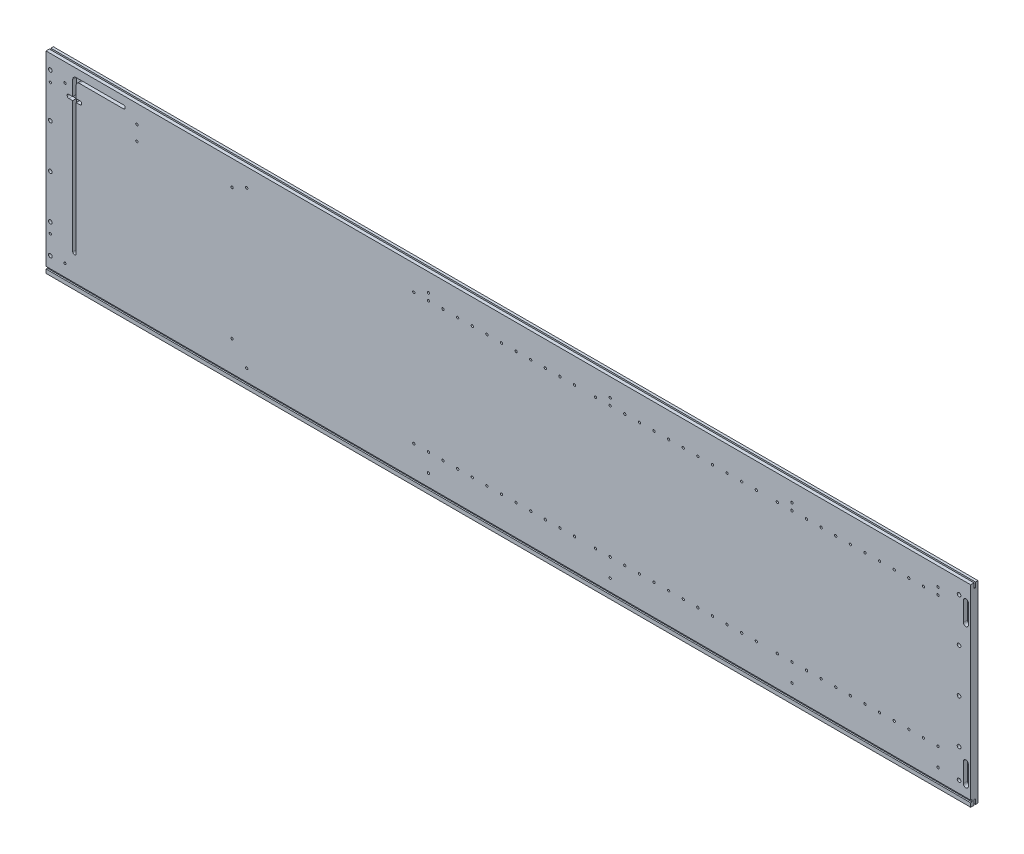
SolidWorks part; units mm, degrees
ref_plane "Ebene vorne" through (0, 0, 0) normal (0, 0, 1) x (1, 0, 0)
ref_plane "Ebene oben" through (0, 0, 0) normal (0, 1, 0) x (1, 0, 0)
ref_plane "Ebene rechts" through (0, 0, 0) normal (1, 0, 0) x (0, 0, -1)
sketch "Skizze1" plane through (0, 0, 0) normal (0, 0, 1) x (1, 0, 0)
  line L1 (-1012.5, -211) -> (1012.5, -211)
  line L2 (-1012.5, -211) -> (-1012.5, 211)
  line L3 (-1012.5, 211) -> (1012.5, 211)
  line L4 (1012.5, -211) -> (1012.5, 211)
  line L5 (-1012.5, -211) -> (1012.5, 211) construction
  line L6 (-1012.5, 211) -> (1012.5, -211) construction
  point P0 (0, 0)
  dimension "D1" = 2025
  dimension "D2" = 422
extrude "Aufsatz-Linear austragen1" add sketch "Skizze1" along normal blind 16
hole_wizard "Ø8.0 (8) Durchmesser Bohrung1 Dübel" positions "Skizze3" profile "Skizze2" hole size "Ø8.0" standard "Din"
sketch "Skizze3" plane through (0, 0, 16) normal (0, 0, 1) x (1, 0, 0)
  line L1 (-1012.5, 211) -> (-1012.5, -211) construction
  line L2 (1012.5, -211) -> (1012.5, 211) construction
  line L3 (-1012.5, -211) -> (1012.5, -211) construction
  point P0 (987, 179.5)
  point P2 (987, 83.5)
  point P4 (987, -12.5)
  point P6 (987, -108.5)
  point P8 (987, -172.5)
  point P10 (-1003, 179.5)
  point P12 (-1003, 83.5)
  point P14 (-1003, -12.5)
  point P16 (-1003, -108.5)
  point P18 (-1003, -172.5)
  dimension "D1" = 38.5
  dimension "D2" = 96
  dimension "D3" = 96
  dimension "D4" = 96
  dimension "D5" = 64
  dimension "D6" = 9.5
  dimension "D7" = 25.5
sketch "Skizze2" plane through (987, 179.5, 16) normal (1, 0, 0) x (0, -1, 0)
  line L0 (0, 0) -> (0, 13.4034)
  line L1 (0, 13.4034) -> (4, 11)
  line L2 (4, 11) -> (4, 0)
  line L5 (4, 0) -> (0, 0)
  line L10 (0, 13.4034) -> (-4, 11) construction
  line L11 (0, -6.35) -> (0, 107.95) construction
  dimension "Bohrerdurchmesser" = 8
  dimension "Bohrungstiefe" = 11
  dimension "Spitzenwinkel" = 118
sketch "Skizze4" plane through (-1012.5, 0, 0) normal (-1, 0, 0) x (0, 0, 1)
  line L0 (16, -211) -> (0, -211) construction
  line L1 (16, 211) -> (16, -211) construction
  line L6 (16, -197.5) -> (13, -197.5)
  line L7 (13, -197.5) -> (13, -202.5)
  line L8 (13, -202.5) -> (16, -202.5)
  line L9 (16, -202.5) -> (16, -197.5)
  dimension "D1" = 13.5
  dimension "D4" = 3
  dimension "D5" = 5
extrude "Schnitt-Linear austragen1 RW-Nut" cut sketch "Skizze4" against normal through all
sketch "Skizze7" plane through (1012.5, 0, 0) normal (1, 0, 0) x (0, 0, -1)
  line L0 (-8.7, 211) -> (-8.7, 200)
  line L1 (-16, 211) -> (0, 211) construction
  line L2 (-8.7, 200) -> (-5.5, 200)
  line L3 (-5.5, 200) -> (-5.5, 211)
  line L4 (-5.5, 211) -> (-8.7, 211)
  line L5 (-16, -197.5) -> (-16, 211) construction
  dimension "D1" = 7.3
  dimension "D2" = 3.2
  dimension "D3" = 11
extrude "Schnitt-Linear austragen3 Alu-Profil-Nut" cut sketch "Skizze7" against normal through all
ref_plane "Ebene1" through (0, 0, 0) normal (0, 1, 0) x (1, 0, 0)
mirror "Spiegeln1" about plane through (0, 0, 0) normal (0, 1, 0) of "Schnitt-Linear austragen3 Alu-Profil-Nut"
sketch "Skizze9" plane through (0, 0, 16) normal (0, 0, 1) x (1, 0, 0)
  line L0 (1001.9, 174) -> (1001.9, 131.8) construction
  line L1 (1007.3, 174) -> (1007.3, 131.8)
  line L2 (996.5, 174) -> (996.5, 131.8)
  line L3 (1001.9, -131.8) -> (1001.9, -174) construction
  line L4 (1007.3, -131.8) -> (1007.3, -174)
  line L5 (996.5, -131.8) -> (996.5, -174)
  line L6 (1012.5, 211) -> (-1012.5, 211) construction
  line L7 (-1012.5, -211) -> (1012.5, -211) construction
  line L8 (1012.5, -211) -> (1012.5, -202.5) construction
  arc A0 (1007.3, 174) -> (996.5, 174) centre (1001.9, 174) ccw
  arc A1 (996.5, 131.8) -> (1007.3, 131.8) centre (1001.9, 131.8) ccw
  arc A2 (1007.3, -131.8) -> (996.5, -131.8) centre (1001.9, -131.8) ccw
  arc A3 (996.5, -174) -> (1007.3, -174) centre (1001.9, -174) ccw
  point P2 (1001.9, 152.9)
  point P7 (1001.9, -152.9)
  dimension "D1" = 10.8
  dimension "D2" = 53
  dimension "D3" = 10.8
  dimension "D4" = 53
  dimension "D5" = 37
  dimension "D6" = 37
  dimension "D7" = 16
extrude "Schnitt-Linear austragen4 Höhenversteller" cut sketch "Skizze9" against normal blind 9
hole_wizard "Ø5.0 (5) Durchmesser Bohrung1 Mittelboden" positions "Skizze11" profile "Skizze10" hole size "Ø5.0" standard "Din"
sketch "Skizze11" plane through (0, 0, 16) normal (0, 0, 1) x (1, 0, 0)
  line L0 (1012.5, -211) -> (1012.5, -202.5) construction
  line L1 (-1012.5, -211) -> (1012.5, -211) construction
  line L2 (1012.5, 211) -> (-1012.5, 211) construction
  point P2 (589, 156)
  point P4 (191, 156)
  point P6 (-207, 156)
  point P8 (-207, -131)
  point P10 (191, -131)
  point P12 (589, -131)
  point P25 (-605, 156)
  point P27 (-605, -131)
  point P35 (-1003, 156)
  point P37 (-1003, -131)
  dimension "D1" = 423.5
  dimension "D2" = 398
  dimension "D3" = 398
  dimension "D4" = 398
  dimension "D5" = 80
  dimension "D6" = 55
  dimension "D7" = 398
sketch "Skizze10" plane through (589, 156, 16) normal (1, 0, 0) x (0, -1, 0)
  line L0 (0, 0) -> (0, 13.5022)
  line L1 (0, 13.5022) -> (2.5, 12)
  line L2 (2.5, 12) -> (2.5, 0)
  line L5 (2.5, 0) -> (0, 0)
  line L10 (0, 13.5022) -> (-2.5, 12) construction
  line L11 (0, -6.35) -> (0, 107.95) construction
  dimension "Bohrerdurchmesser" = 5
  dimension "Bohrungstiefe" = 12
  dimension "Spitzenwinkel" = 118
hole_wizard "Ø5.0 (5) Durchmesser Bohrung2 Verbinder" positions "Skizze13" profile "Skizze12" hole size "Ø5.0" standard "Din"
sketch "Skizze13" plane through (0, 0, 16) normal (0, 0, 1) x (1, 0, 0)
  line L0 (1012.5, -211) -> (1012.5, -202.5) construction
  line L1 (1012.5, 211) -> (-1012.5, 211) construction
  line L2 (-1012.5, -211) -> (1012.5, -211) construction
  line L4 (-1012.5, -202.5) -> (-1012.5, -211) construction
  point P0 (941, 171)
  point P2 (621, 171)
  point P4 (223, 171)
  point P6 (-175, 171)
  point P8 (-573, 171)
  point P10 (-971, 171)
  point P12 (-971, -171)
  point P14 (-573, -171)
  point P16 (-175, -171)
  point P18 (223, -171)
  point P20 (621, -171)
  point P22 (941, -171)
  dimension "D1" = 71.5
  dimension "D2" = 40
  dimension "D3" = 40
  dimension "D4" = 320
  dimension "D5" = 398
  dimension "D6" = 398
  dimension "D7" = 398
  dimension "D8" = 398
  dimension "D9" = 41.5
sketch "Skizze12" plane through (941, 171, 16) normal (1, 0, 0) x (0, -1, 0)
  line L0 (0, 0) -> (0, 16)
  line L1 (0, 16) -> (2.5, 16)
  line L2 (2.5, 16) -> (2.5, 0)
  line L5 (2.5, 0) -> (0, 0)
  line L11 (0, -6.35) -> (0, 107.95) construction
  dimension "Bohrerdurchmesser" = 5
  dimension "Bohrungstiefe" = 16
sketch "Skizze15" plane through (0, -200, 0) normal (0, -1, 0) x (1, 0, 0)
  line L0 (-1012.5, 8.7) -> (-1004.1348, 8.7)
  line L1 (-1012.5, 8.7) -> (1012.5, 8.7) construction
  line L2 (-1004.1348, 8.7) -> (-1004.1348, 5.5)
  line L3 (-1012.5, 5.5) -> (1012.5, 5.5) construction
  line L4 (-1004.1348, 5.5) -> (-1012.5, 5.5)
  line L5 (-1012.5, 5.5) -> (-1012.5, 8.7)
  dimension "D1" = 8.3652
extrude "Schnitt-Linear austragen1Alu-Profil-Nut" cut sketch "Skizze15" against normal through all
hole_wizard "Ø5.0 (5) Durchmesser Bohrung1" positions "Skizze17" profile "Skizze16" hole size "Ø5.0" standard "Din"
sketch "Skizze17" plane through (0, 0, 16) normal (0, 0, 1) x (1, 0, 0)
  circle A0 centre (191, 156) radius 2.5 construction
  point P138 (621, 156)
  point P150 (653, 156)
  point P151 (685, 156)
  point P152 (717, 156)
  point P153 (749, 156)
  point P154 (781, 156)
  point P155 (813, 156)
  point P156 (845, 156)
  point P157 (877, 156)
  point P158 (909, 156)
  point P159 (941, 156)
  point P161 (621, -131)
  point P166 (653, -131)
  point P167 (685, -131)
  point P168 (717, -131)
  point P169 (749, -131)
  point P170 (781, -131)
  point P171 (813, -131)
  point P172 (845, -131)
  point P173 (877, -131)
  point P174 (909, -131)
  point P175 (941, -131)
  point P204 (-175, 156)
  point P208 (-143, 156)
  point P209 (-111, 156)
  point P210 (-79, 156)
  point P211 (-47, 156)
  point P212 (-15, 156)
  point P213 (17, 156)
  point P214 (49, 156)
  point P215 (81, 156)
  point P216 (113, 156)
  point P217 (145, 156)
  point P219 (-175, -131)
  point P223 (-143, -131)
  point P224 (-111, -131)
  point P225 (-79, -131)
  point P226 (-47, -131)
  point P227 (-15, -131)
  point P228 (17, -131)
  point P229 (49, -131)
  point P230 (81, -131)
  point P231 (113, -131)
  point P232 (145, -131)
  point P234 (223, 156)
  point P239 (255, 156)
  point P240 (287, 156)
  point P241 (319, 156)
  point P242 (351, 156)
  point P243 (383, 156)
  point P244 (415, 156)
  point P245 (447, 156)
  point P246 (479, 156)
  point P247 (511, 156)
  point P248 (543, 156)
  point P250 (223, -131)
  point P255 (255, -131)
  point P256 (287, -131)
  point P257 (319, -131)
  point P258 (351, -131)
  point P259 (383, -131)
  point P260 (415, -131)
  point P261 (447, -131)
  point P262 (479, -131)
  point P263 (511, -131)
  point P264 (543, -131)
  dimension "D11" = 32
  dimension "D1" = 11
  dimension "D2" = 32
  dimension "D3" = 11
  dimension "D4" = 11
  dimension "D5" = 11
  dimension "D6" = 32
  dimension "D7" = 11
  dimension "D8" = 32
  dimension "D9" = 11
  dimension "D10" = 32
  dimension "D12" = 32
  dimension "D13" = 46
  dimension "D14" = 46
sketch "Skizze16" plane through (621, 156, 16) normal (1, 0, 0) x (0, -1, 0)
  line L0 (0, 0) -> (0, 8.5022)
  line L1 (0, 8.5022) -> (2.5, 7)
  line L2 (2.5, 7) -> (2.5, 0)
  line L5 (2.5, 0) -> (0, 0)
  line L10 (0, 8.5022) -> (-2.5, 7) construction
  line L11 (0, -6.35) -> (0, 107.95) construction
  dimension "Bohrerdurchmesser" = 5
  dimension "Bohrungstiefe" = 7
  dimension "Spitzenwinkel" = 118
sketch "Skizze18" plane through (0, 0, 16) normal (0, 0, 1) x (1, 0, 0)
  line L0 (-946.5, -140.75) -> (-946.5, 146)
  line L1 (-842.75, 193.5) -> (-946.5, 193.5)
  line L2 (-954, 186) -> (-954, 153.5)
  line L3 (1012.5, 211) -> (-1012.5, 211) construction
  line L4 (-939, 186) -> (-842.75, 186)
  line L5 (-962.505, 149.75) -> (-937.995, 149.75) construction
  line L6 (-962.505, 153.5) -> (-954, 153.5)
  line L7 (-962.505, 146) -> (-954, 146)
  line L8 (-950.25, 211) -> (-950.25, -211) construction
  line L9 (-946.5, 153.5) -> (-937.995, 153.5)
  line L10 (-946.5, 146) -> (-937.995, 146)
  line L11 (-954, 146) -> (-954, -140.75)
  line L12 (-946.5, 153.5) -> (-946.5, 178.5)
  line L13 (-1012.5, -211) -> (1012.5, -211) construction
  arc A0 (-946.5, 193.5) -> (-954, 186) centre (-946.5, 186) ccw
  arc A1 (-954, -140.75) -> (-946.5, -140.75) centre (-950.25, -140.75) ccw
  arc A2 (-946.5, 178.5) -> (-939, 186) centre (-939, 178.5) cw
  arc A3 (-842.75, 186) -> (-842.75, 193.5) centre (-842.75, 189.75) ccw
  arc A4 (-962.505, 153.5) -> (-962.505, 146) centre (-962.505, 149.75) ccw
  arc A5 (-937.995, 146) -> (-937.995, 153.5) centre (-937.995, 149.75) ccw
  dimension "D3" = 3.75
  dimension "D1" = 7.5
  dimension "D10" = 7.5
  dimension "D12" = 3.75
  dimension "D13" = 7.5
  dimension "D2" = 7.5
  dimension "D4" = 17.5
  dimension "D5" = 7.5
  dimension "D6" = 24.51
  dimension "D7" = 61.25
  dimension "D8" = 351.75
  dimension "D9" = 160.25
  dimension "D11" = 52.75
extrude "Schnitt-Linear austragen1 Klappe" cut sketch "Skizze18" against normal blind 8
hole_wizard "Ø5.0 (5) Bohrung2 Klappe" positions "Skizze20" profile "Skizze19" hole size "Ø5.0" standard "Din"
sketch "Skizze20" plane through (0, 0, 16) normal (0, 0, 1) x (1, 0, 0)
  line L0 (1012.5, 211) -> (-1012.5, 211) construction
  point P0 (-813.5, 171)
  point P2 (-813.5, 139)
  dimension "D1" = 40
  dimension "D2" = 32
  dimension "D3" = 189.5
sketch "Skizze19" plane through (-813.5, 171, 16) normal (1, 0, 0) x (0, -1, 0)
  line L0 (0, 0) -> (0, 9.5022)
  line L1 (0, 9.5022) -> (2.5, 8)
  line L2 (2.5, 8) -> (2.5, 0)
  line L5 (2.5, 0) -> (0, 0)
  line L10 (0, 9.5022) -> (-2.5, 8) construction
  line L11 (0, -6.35) -> (0, 107.95) construction
  dimension "Bohrerdurchmesser" = 5
  dimension "Bohrungstiefe" = 8
  dimension "Spitzenwinkel" = 118
